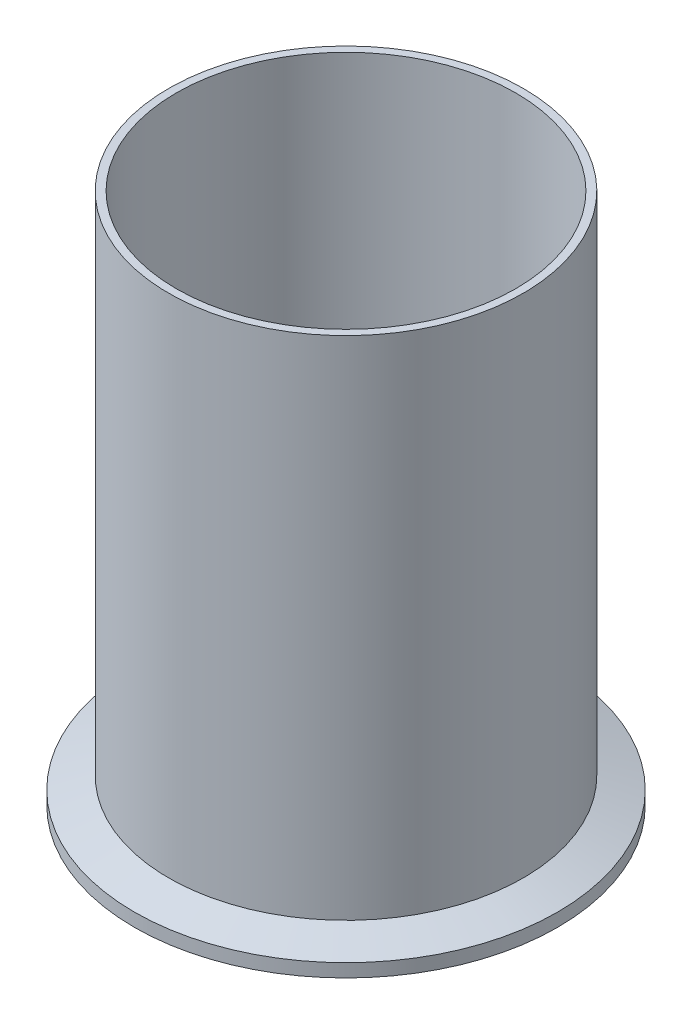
SolidWorks part; units mm, degrees
ref_plane "Front Plane" through (0, 0, 0) normal (0, 0, 1) x (1, 0, 0)
ref_plane "Top Plane" through (0, 0, 0) normal (0, 1, 0) x (1, 0, 0)
ref_plane "Right Plane" through (0, 0, 0) normal (1, 0, 0) x (0, 0, -1)
sketch "Sketch1" plane through (0, 0, 0) normal (0, 0, 1) x (1, 0, 0)
  line L0 (0, 0) -> (0, 114.3) construction
  line L1 (0, 114.3) -> (-38.1, 114.3)
  line L2 (-38.1, 114.3) -> (-38.1, 5.5212)
  line L3 (-38.1, 5.5212) -> (-45.4533, 2.8448)
  line L4 (-45.4533, 2.8448) -> (-45.4533, 0)
  line L5 (-45.4533, 0) -> (-43.4867, 0)
  line L6 (-39.8507, 0) -> (0, 0)
  line L7 (0, 0) -> (0, 114.3)
  line L8 (0, 114.3) -> (-36.449, 114.3)
  line L9 (-36.449, 114.3) -> (-36.449, 0)
  line L10 (-36.449, 0) -> (0, 0)
  line L11 (0, 0) -> (-0.1846, 0.0129)
  arc A0 (-42.7642, 0.4745) -> (-40.5732, 0.4745) centre (-41.6687, 0) cw
  arc A1 (-39.8507, 0) -> (-40.5732, 0.4745) centre (-39.8507, 0.7874) cw
  arc A2 (-42.7642, 0.4745) -> (-43.4867, 0) centre (-43.4867, 0.7874) cw
  point P12 (-40.4749, 0)
  dimension "D6" = 1.1938
  dimension "D7" = 0.7874
  dimension "D1" = 38.1
  dimension "D2" = 2.8448
  dimension "D3" = 45.4533
  dimension "D4" = 70
  dimension "D5" = 41.6687
  dimension "D8" = 1.651
  dimension "D9" = 114.3
revolve "Revolve2" add sketch "Sketch1" angle 360 about L0
